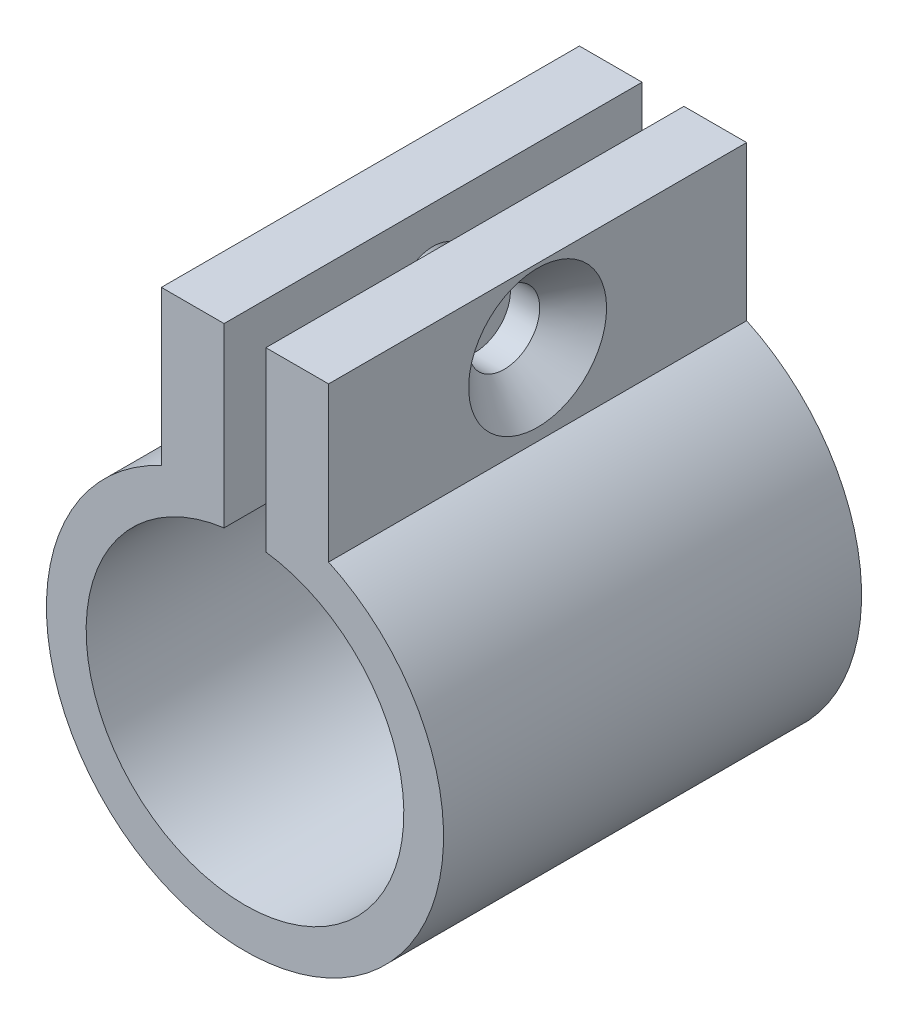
SolidWorks part; units mm, degrees
ref_plane "前视基准面" through (0, 0, 0) normal (0, 0, 1) x (1, 0, 0)
ref_plane "上视基准面" through (0, 0, 0) normal (0, 1, 0) x (1, 0, 0)
ref_plane "右视基准面" through (0, 0, 0) normal (1, 0, 0) x (0, 0, -1)
other "Configuration Table"
sketch "草图1" plane through (0, 0, 0) normal (0, 0, 1) x (1, 0, 0)
  circle A0 centre (0, 0) radius 7.6
  circle A1 centre (0, 0) radius 9.5
  dimension "D1" = 15.2
  dimension "D2" = 19
extrude "凸台-拉伸1" add sketch "草图1" along normal blind 20
sketch "草图4" plane through (0, 0, 20) normal (0, 0, 1) x (1, 0, 0)
  line L0 (-4, 6.4622) -> (-4, 18)
  line L3 (-4, 18) -> (4, 18)
  line L6 (-4, 18) -> (-1.6487, 7.419) construction
  line L8 (1.6487, 7.419) -> (4, 18) construction
  line L9 (4, 6.4622) -> (4, 18)
  arc A1 (4, 6.4622) -> (-4, 6.4622) centre (0, 0) ccw
  point P0 (0, 0)
  dimension "D1" = 8
extrude "凸台-拉伸3" add sketch "草图4" against normal blind 20
sketch "草图10" plane through (0, 0, 20) normal (0, 0, 1) x (1, 0, 0)
  line L2 (-1, 7.5339) -> (-1, 25)
  line L3 (-1, 25) -> (1, 25)
  line L4 (1, 7.5339) -> (1, 25)
  line L5 (0, 0) -> (1, 25) construction
  line L6 (-1, 25) -> (0, 0) construction
  arc A0 (1, 7.5339) -> (-1, 7.5339) centre (0, 0) ccw
  point P0 (0, 0)
  dimension "D3" = 15.2
  dimension "D1" = 2
extrude "切除-拉伸3" cut sketch "草图10" against normal blind 20
hole_wizard "M3 十字槽沉头木螺钉的锥形沉头孔1" positions "草图11" profile "草图12" countersink size "M3" standard "GB"
sketch "草图11" plane through (4, 0, 0) normal (1, 0, 0) x (0, 0, -1)
  line L0 (-20, 8.6168) -> (-20, 18) construction
  line L1 (0, 18) -> (-20, 18) construction
  point P0 (-10, 12.5)
  dimension "D1" = 10
  dimension "D2" = 5.5
sketch "草图12" plane through (4, 12.5, 10) normal (0, 1, 0) x (0, 0, -1)
  line L0 (0, 0) -> (0, 13.5)
  line L1 (0, 13.5) -> (1.7, 13.5)
  line L2 (1.7, 13.5) -> (1.7, 1.6)
  line L3 (1.7, 1.6) -> (3.3, 0)
  line L5 (3.3, 0) -> (0, 0)
  line L6 (-1.7, 1.6) -> (-3.3, 0) construction
  line L11 (0, -6.35) -> (0, 107.95) construction
  dimension "通孔孔直径" = 3.4
  dimension "通孔孔深度" = 13.5
  dimension "近端锥形沉头孔直径" = 6.6
  dimension "近端锥形沉头孔角度" = 90
sketch "草图13" plane through (0, 18, 0) normal (0, 1, 0) x (1, 0, 0)
  line L1 (-8.6864, 4.7771) -> (13.0914, 4.7771)
  line L2 (-8.6864, 4.7771) -> (-8.6864, -24.411)
  line L3 (-8.6864, -24.411) -> (13.0914, -24.411)
  line L4 (13.0914, 4.7771) -> (13.0914, -24.411)
extrude "切除-拉伸4" cut sketch "草图13" against normal blind 2
